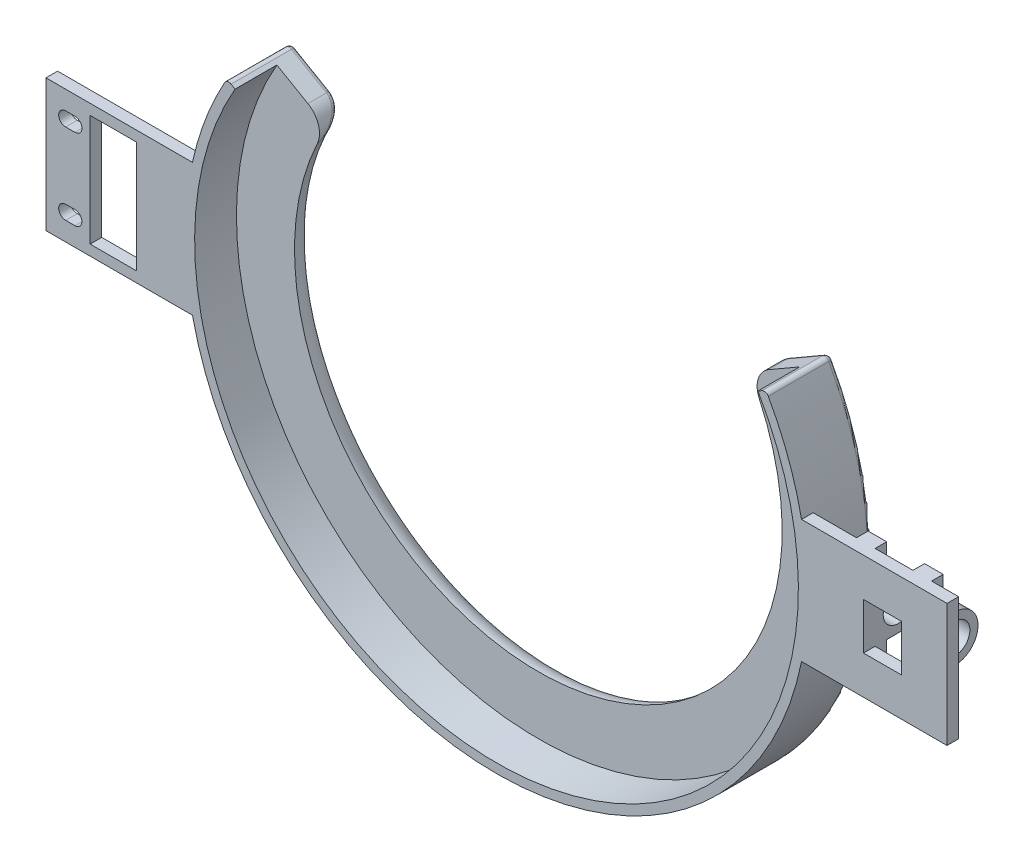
SolidWorks part; units mm, degrees
ref_plane "前视基准面" through (0, 0, 0) normal (0, 0, 1) x (1, 0, 0)
ref_plane "上视基准面" through (0, 0, 0) normal (0, 1, 0) x (1, 0, 0)
ref_plane "右视基准面" through (0, 0, 0) normal (1, 0, 0) x (0, 0, -1)
sketch "草图1" plane through (0, 0, 0) normal (0, 0, 1) x (1, 0, 0)
  circle A0 centre (0, 0) radius 67
  dimension "D1" = 134
extrude "凸台-拉伸1" add sketch "草图1" along normal blind 15 contours A0
sketch "草图2" plane through (0, 0, 15) normal (0, 0, 1) x (1, 0, 0)
  circle A0 centre (0, 0) radius 65
  dimension "D1" = 130
extrude "切除-拉伸1" cut sketch "草图2" against normal blind 10
sketch "草图3" plane through (0, 0, 0) normal (0, 0, -1) x (-1, 0, 0)
  circle A0 centre (0, 0) radius 52.5
  dimension "D1" = 105
extrude "切除-拉伸2" cut sketch "草图3" against normal blind 10
sketch "草图4" plane through (0, 0, 15) normal (0, 0, 1) x (1, 0, 0)
  line L1 (-82.2608, 71.999) -> (79.8044, 71.999)
  line L2 (-82.2608, 71.999) -> (-82.2608, -68.1077)
  line L3 (-82.2608, -68.1077) -> (79.8044, -68.1077)
  line L4 (79.8044, 71.999) -> (79.8044, -68.1077)
extrude "切除-拉伸3" cut sketch "草图4" against normal blind 2
sketch "草图5" plane through (0, 0, 0) normal (0, 1, 0) x (1, 0, 0)
  line L1 (67, -13) -> (97, -13)
  line L2 (67, -13) -> (67, -11.5)
  line L3 (67, -11.5) -> (97, -11.5)
  line L4 (97, -13) -> (97, -11.5)
  dimension "D1" = 30
  dimension "D2" = 1.5
extrude "凸台-拉伸2" add sketch "草图5" along normal blind 13.25 separate body
sketch "草图6" plane through (0, 0, 0) normal (0, -1, 0) x (1, 0, 0)
  line L1 (67, 13) -> (97, 13)
  line L2 (67, 13) -> (67, 11.5)
  line L3 (67, 11.5) -> (97, 11.5)
  line L4 (97, 13) -> (97, 11.5)
extrude "凸台-拉伸3" add sketch "草图6" along normal blind 13.25
sketch "草图7" plane through (97, 0, 0) normal (1, 0, 0) x (0, 0, -1)
  line L0 (-11.5, -13.25) -> (-13, -13.25) construction
  line L1 (-13, 13.25) -> (-11.5, 13.25)
  line L2 (-13, 13.25) -> (-13, -13.25)
  line L3 (-13, -13.25) -> (-11.5, -13.25)
  line L4 (-11.5, 13.25) -> (-11.5, -13.25)
  line L5 (-11.5, 13.25) -> (-11.5, -13.25) construction
extrude "凸台-拉伸5" add sketch "草图7" against normal blind 194
sketch "草图8" plane through (0, 0, 13) normal (0, 0, 1) x (1, 0, 0)
  circle A0 centre (0, 0) radius 65
  dimension "D1" = 130
extrude "切除-拉伸6" cut sketch "草图8" against normal blind 5
sketch "草图9" plane through (0, 0, 0) normal (0, 0, -1) x (-1, 0, 0)
  line L0 (-58.0237, 33.5) -> (58.0237, 33.5) construction
  line L1 (-58.0237, 33.5) -> (0, 0) construction
  line L2 (0, 0) -> (58.0237, 33.5) construction
  line L3 (-58.0237, 33.5) -> (0, 0)
  line L4 (0, 0) -> (58.0237, 33.5)
  arc A0 (-58.0237, 33.5) -> (58.0237, 33.5) centre (0, 0) cw
  circle A1 centre (0, 0) radius 67 construction
  dimension "D1" = 120
extrude "切除-拉伸7" cut sketch "草图9" against normal up to surface (13 mm away)
sketch "草图11" plane through (0, 0, 11.5) normal (0, 0, -1) x (-1, 0, 0)
  line L0 (97, 0) -> (67, 0)
  line L1 (97, -13.25) -> (97, 13.25) construction
  line L2 (90.769, -8.7039) -> (92.769, -8.7039) construction
  line L7 (90.769, -7.2039) -> (92.769, -7.2039)
  line L8 (90.769, -10.2039) -> (92.769, -10.2039)
  line L9 (90.769, 8.7039) -> (92.769, 8.7039) construction
  line L10 (90.769, 7.2039) -> (92.769, 7.2039)
  line L11 (90.769, 10.2039) -> (92.769, 10.2039)
  arc A2 (90.769, -7.2039) -> (90.769, -10.2039) centre (90.769, -8.7039) ccw
  arc A3 (92.769, -10.2039) -> (92.769, -7.2039) centre (92.769, -8.7039) ccw
  arc A4 (65.6768, -13.25) -> (65.6768, 13.25) centre (0, 0) ccw construction
  arc A5 (90.769, 7.2039) -> (90.769, 10.2039) centre (90.769, 8.7039) cw
  arc A6 (92.769, 10.2039) -> (92.769, 7.2039) centre (92.769, 8.7039) cw
  point P2 (91.769, -8.7039)
  point P16 (91.769, 8.7039)
  dimension "D1" = 2
  dimension "D2" = 1.5
fillet "圆角12" [suppressed] radius 1
fillet "圆角13" radius 1 1 edges at (51.745, 29.875, 0)
fillet "圆角14" radius 1 1 edges at (-51.745, 29.875, 0)
fillet "圆角15" radius 1 5 edges at (-58.0237, 33.5, 7) (-58.133, 33.31, 0.3753) (58.0237, 33.5, 7) (58.2105, 33.1744, 0.2191) (0, -67, 0)
fillet "圆角16" radius 5 5 edges at (-45.6528, 25.9243, 0.2191) (0, -52.5, 0) (45.5755, 26.06, 0.3753) (45.4663, 26.25, 3) (-45.4663, 26.25, 3)
extrude "切除-拉伸11" cut sketch "草图11" against normal blind 10
sketch "草图12" plane through (0, 0, 11.5) normal (0, 0, -1) x (-1, 0, 0)
  line L0 (-65.6768, 13.25) -> (-97, 13.25) construction
  line L1 (-79.01, 13.25) -> (-75.01, 13.25)
  line L2 (-79.01, 13.25) -> (-79.01, -13.25)
  line L3 (-79.01, -13.25) -> (-75.01, -13.25)
  line L4 (-75.01, 13.25) -> (-75.01, -13.25)
  dimension "D1" = 4
  dimension "D2" = 26.5
  dimension "D3" = 79.01
extrude "凸台-拉伸6" add sketch "草图12" along normal blind 10
sketch "草图13" plane through (0, 0, 11.5) normal (0, 0, -1) x (-1, 0, 0)
  line L0 (-79.01, 13.25) -> (-97, 13.25) construction
  line L1 (-91.17, 13.25) -> (-87.17, 13.25)
  line L2 (-91.17, 13.25) -> (-91.17, -13.25)
  line L3 (-91.17, -13.25) -> (-87.17, -13.25)
  line L4 (-87.17, 13.25) -> (-87.17, -13.25)
  line L5 (-79.01, -13.25) -> (-97, -13.25) construction
  dimension "D1" = 87.17
  dimension "D2" = 4
extrude "凸台-拉伸7" add sketch "草图13" along normal blind 10
sketch "草图14" plane through (91.17, 0, 0) normal (1, 0, 0) x (0, 0, -1)
  line L0 (-11.5, 13.25) -> (-1.5, -13.25) construction
  line L1 (-1.5, 13.25) -> (-1.5, -13.25) construction
  circle A0 centre (-6.5, 0) radius 3.25
  point P7 (-6.5, 0)
  dimension "D1" = 6.5
extrude "切除-拉伸12" cut sketch "草图14" against normal blind 17
sketch "草图15" plane through (0, 0, 11.5) normal (0, 0, -1) x (-1, 0, 0)
  line L0 (-87.17, -13.25) -> (-87.17, 13.25) construction
  line L1 (-87.17, 5) -> (-79.01, 5)
  line L2 (-87.17, 5) -> (-87.17, -5)
  line L3 (-87.17, -5) -> (-79.01, -5)
  line L4 (-79.01, 5) -> (-79.01, -5)
  line L5 (-79.01, 13.25) -> (-79.01, -13.25) construction
  line L6 (-79.01, 13.25) -> (-79.01, -13.25) construction
  point P10 (-79.01, 0)
  point P11 (-79.01, 0)
  dimension "D1" = 10
extrude "切除-拉伸13" cut sketch "草图15" against normal through all
sketch "草图16" plane through (0, 0, 11.5) normal (0, 0, -1) x (-1, 0, 0)
  line L0 (87.5, 0) -> (0, 0)
  line L1 (77.5, 12) -> (87.5, 12)
  line L2 (77.5, 12) -> (77.5, -12)
  line L3 (77.5, -12) -> (87.5, -12)
  line L4 (87.5, 12) -> (87.5, -12)
  line L5 (97, -13.25) -> (65.6768, -13.25) construction
  dimension "D1" = 77.5
  dimension "D2" = 87.5
  dimension "D3" = 24
extrude "切除-拉伸14" cut sketch "草图16" against normal through all contours L4 L1 L2 L0 | L4 L0 L2 L3
sketch "草图21" plane through (0, 13.25, 0) normal (0, 1, 0) x (1, 0, 0)
  line L0 (-65.6768, -13) -> (-58.5246, -13) construction
  line L1 (-97, -11.5) -> (-64.4291, -11.5)
  line L2 (-97, -11.5) -> (-97, -13)
  line L3 (-97, -13) -> (-64.4291, -13)
  line L4 (-64.4291, -11.5) -> (-64.4291, -13)
extrude "凸台-拉伸12" add sketch "草图21" along normal blind 1
sketch "草图22" plane through (0, -13.25, 0) normal (0, -1, 0) x (1, 0, 0)
  line L1 (-97, 13) -> (-64.8942, 13)
  line L2 (-97, 13) -> (-97, 11.5)
  line L3 (-97, 11.5) -> (-64.8942, 11.5)
  line L4 (-64.8942, 13) -> (-64.8942, 11.5)
extrude "凸台-拉伸13" add sketch "草图22" along normal blind 1
sketch "Sketch2" plane through (91.17, 0, 0) normal (1, 0, 0) x (0, 0, -1)
  line L0 (-6.5, 5) -> (-11.5, 5)
  line L1 (-11.5, -13.25) -> (-11.5, 13.25) construction
  line L2 (-6.5, -5) -> (-11.5, -5)
  line L3 (-9, 13.25) -> (-9, 5)
  line L4 (-1.5, 13.25) -> (-11.5, 13.25) construction
  line L5 (-9, -5) -> (-9, -13.25)
  line L6 (-1.5, -13.25) -> (-11.5, -13.25) construction
  circle A0 centre (-6.5, 0) radius 5
extrude "Cut-Extrude1" cut sketch "Sketch2" against normal blind 17 contours A0 L3 L0 M5 M6 | A0 L2 L5 M4 M5
sketch "Sketch4" plane through (0, 0, 13) normal (0, 0, 1) x (1, 0, 0)
  line L0 (87.17, 5) -> (87.17, -5) construction
  line L1 (87.17, -5) -> (79.01, -5) construction
  line L2 (79.01, -5) -> (79.01, 5) construction
  line L3 (79.01, 5) -> (87.17, 5) construction
  line L4 (-92.769, -10.2039) -> (-90.769, -10.2039) construction
  line L5 (-92.769, -7.2039) -> (-90.769, -7.2039) construction
  line L6 (-92.769, 10.2039) -> (-90.769, 10.2039) construction
  line L7 (-92.769, 7.2039) -> (-90.769, 7.2039) construction
  line L8 (-97, -14.25) -> (-65.4671, -14.25)
  line L9 (65.6768, -13.25) -> (97, -13.25)
  line L10 (97, -13.25) -> (97, 13.25)
  line L11 (97, 13.25) -> (65.6768, 13.25)
  line L12 (57.1511, 32.9962) -> (56.2917, 32.5)
  line L13 (-56.2917, 32.5) -> (-57.1511, 32.9962)
  line L14 (-65.4671, 14.25) -> (-97, 14.25)
  line L15 (-97, 14.25) -> (-97, -14.25)
  line L16 (-97, -14.25) -> (-65.4671, -14.25)
  line L17 (65.6768, -13.25) -> (97, -13.25)
  line L18 (97, -13.25) -> (97, 13.25)
  line L19 (97, 13.25) -> (65.6768, 13.25)
  line L20 (57.1511, 32.9962) -> (56.2917, 32.5)
  line L21 (-56.2917, 32.5) -> (-57.1511, 32.9962)
  line L22 (-65.4671, 14.25) -> (-97, 14.25)
  line L23 (-97, 14.25) -> (-97, -14.25)
  line L24 (-77.5, -12) -> (-87.5, -12) construction
  line L25 (-77.5, 12) -> (-77.5, -12) construction
  line L26 (-77.5, 12) -> (-87.5, 12) construction
  line L27 (-87.5, 12) -> (-87.5, -12) construction
  line L28 (87.17, 5) -> (87.17, -5)
  line L29 (87.17, -5) -> (79.01, -5)
  line L30 (79.01, -5) -> (79.01, 5)
  line L31 (79.01, 5) -> (87.17, 5)
  line L32 (-92.769, -10.2039) -> (-90.769, -10.2039)
  line L33 (-92.769, -7.2039) -> (-90.769, -7.2039)
  line L34 (-92.769, 10.2039) -> (-90.769, 10.2039)
  line L35 (-92.769, 7.2039) -> (-90.769, 7.2039)
  line L36 (-77.5, -12) -> (-87.5, -12)
  line L37 (-77.5, 12) -> (-77.5, -12)
  line L38 (-77.5, 12) -> (-87.5, 12)
  line L39 (-87.5, 12) -> (-87.5, -12)
  arc A0 (-90.769, -10.2039) -> (-90.769, -7.2039) centre (-90.769, -8.7039) ccw construction
  arc A1 (-92.769, -7.2039) -> (-92.769, -10.2039) centre (-92.769, -8.7039) ccw construction
  arc A2 (-90.769, 7.2039) -> (-90.769, 10.2039) centre (-90.769, 8.7039) ccw construction
  arc A3 (-92.769, 10.2039) -> (-92.769, 7.2039) centre (-92.769, 8.7039) ccw construction
  arc A4 (-90.769, -10.2039) -> (-90.769, -7.2039) centre (-90.769, -8.7039) ccw
  arc A5 (-92.769, -7.2039) -> (-92.769, -10.2039) centre (-92.769, -8.7039) ccw
  arc A6 (-65.4671, -14.25) -> (65.6768, -13.25) centre (0, 0) ccw
  arc A7 (65.6768, 13.25) -> (58.5246, 32.617) centre (0, 0) ccw
  arc A8 (58.5246, 32.617) -> (57.1511, 32.9962) centre (57.6511, 32.1302) ccw
  arc A9 (-56.2917, 32.5) -> (56.2917, 32.5) centre (0, 0) ccw
  arc A10 (-57.1511, 32.9962) -> (-58.5246, 32.617) centre (-57.6511, 32.1302) ccw
  arc A11 (-58.5246, 32.617) -> (-65.4671, 14.25) centre (0, 0) ccw
  arc A12 (-65.4671, -14.25) -> (65.6768, -13.25) centre (0, 0) ccw
  arc A13 (65.6768, 13.25) -> (58.5246, 32.617) centre (0, 0) ccw
  arc A14 (58.5246, 32.617) -> (57.1511, 32.9962) centre (57.6511, 32.1302) ccw
  arc A15 (-56.2917, 32.5) -> (56.2917, 32.5) centre (0, 0) ccw
  arc A16 (-57.1511, 32.9962) -> (-58.5246, 32.617) centre (-57.6511, 32.1302) ccw
  arc A17 (-58.5246, 32.617) -> (-65.4671, 14.25) centre (0, 0) ccw
  arc A18 (-90.769, 7.2039) -> (-90.769, 10.2039) centre (-90.769, 8.7039) ccw
  arc A19 (-92.769, 10.2039) -> (-92.769, 7.2039) centre (-92.769, 8.7039) ccw
  dimension "D1" = 0
extrude "Boss-Extrude2" add sketch "Sketch4" along normal blind 1
